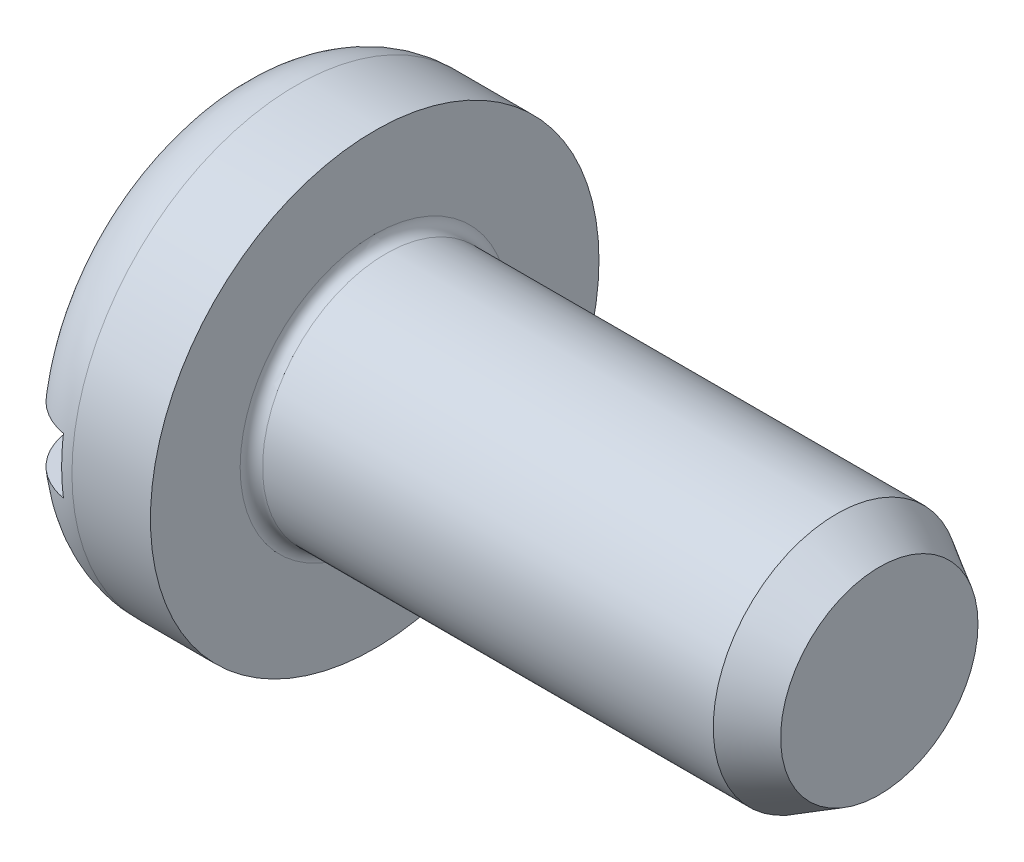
SolidWorks part; units mm, degrees
ref_plane "Front" through (0, 0, 0) normal (0, 0, 1) x (1, 0, 0)
ref_plane "Top" through (0, 0, 0) normal (0, 1, 0) x (1, 0, 0)
ref_plane "Right" through (0, 0, 0) normal (1, 0, 0) x (0, 0, -1)
other "Configuration Table"
sketch "Sketch1" plane through (0, 0, 0) normal (0, 0, 1) x (1, 0, 0)
  line L0 (0, 0) -> (0, 2)
  line L1 (0, 2) -> (1.3, 2)
  line L2 (1.3, 2) -> (1.3, 1.1)
  line L4 (1.3, 1.1) -> (5.8, 1.1)
  line L5 (5.8, 1.1) -> (5.8, 0)
  line L6 (5.8, 0) -> (0, 0)
  line L7 (13.1079, 0) -> (-2.2203, 0) construction
revolve "Revolve1" add sketch "Sketch1" angle 360 about L7
chamfer "Chamfer1" distance 0.22 angle 60 1 edges at (5.8, 0, -1.1)
sketch "Sketch6" plane through (0, 0, 0) normal (0, 0, 1) x (1, 0, 0)
  line L0 (2.0155, 0.815) -> (1.5445, 0.815)
  line L1 (1.5445, 0.815) -> (1.38, 1.1)
  line L2 (2.0155, 0.815) -> (2.18, 1.1)
  line L3 (1.38, 1.1) -> (1.38, 1.35)
  line L4 (2.18, 1.1) -> (2.18, 1.35)
  line L5 (1.38, 1.35) -> (2.18, 1.35)
  line L6 (1.78, 0.815) -> (1.78, 0) construction
  line L7 (0, 0) -> (7.3035, 0) construction
revolve "ThreadSchematic" [suppressed] cut sketch "Sketch6" angle 360 about L7
pattern_linear "ThdSchPat" [suppressed] count 6 spacing 0.8 along (-1, 0, 0)
sketch "Sketch5" plane through (0, 0, 0) normal (0, 0, 1) x (1, 0, 0)
  line L1 (5.8, 1.1) -> (5.8, 0) construction
  line L3 (3.5, -1.1) -> (4, -1.1) construction
  line L4 (0, 0) -> (6.648, 0) construction
  line L5 (5.8, 0) -> (4, -1.1)
  line L6 (5.8, 0) -> (6, 0)
  line L7 (6, 0) -> (6, -1.3)
  line L8 (6, -1.3) -> (4, -1.3)
  line L9 (4, -1.3) -> (4, -1.1)
  line L10 (4, -1.1) -> (6.8602, -1.1) construction
revolve "EndCone" [suppressed] cut sketch "Sketch5" angle 360 about L4
fillet "Fillet1" radius 0.1 1 edges at (1.3, 0, -1.1)
fillet "Fillet2" radius 0.6 1 edges at (0, 0, -2)
sketch "Sketch7" plane through (0, 0, 0) normal (0, 0, 1) x (1, 0, 0)
  line L0 (0, 0) -> (-1.1882, 0) construction
  line L1 (-1, 0.25) -> (0.5, 0.25)
  line L2 (-1, 0.25) -> (-1, -0.25)
  line L3 (-1, -0.25) -> (0.5, -0.25)
  line L4 (0.5, 0.25) -> (0.5, -0.25)
  dimension "D1" = 1
  dimension "n" = 0.5
  dimension "t" = 0.5
extrude "Slot" cut sketch "Sketch7" against normal mid plane 30
equation "\"minordia@Sketch6\" = \"D2@ThreadCosmetic\""
equation "\"D1@Chamfer1\" = \"d@Sketch1\" / 10"
equation "\"D1@ThdSchPat\" = int((\"l@Sketch1\"/\"advance@Sketch6\") + 0.8)"
equation "\"D3@ThdSchPat\" = \"advance@Sketch6\""
equation "\"D1@Sketch6\" = \"d@Sketch1\""
equation "\"D4@Sketch5\" = \"d@Sketch1\""
equation "\"threadstart@Sketch6\" = \"k@Sketch1\" + \"advance@Sketch6\" * 0.6"
